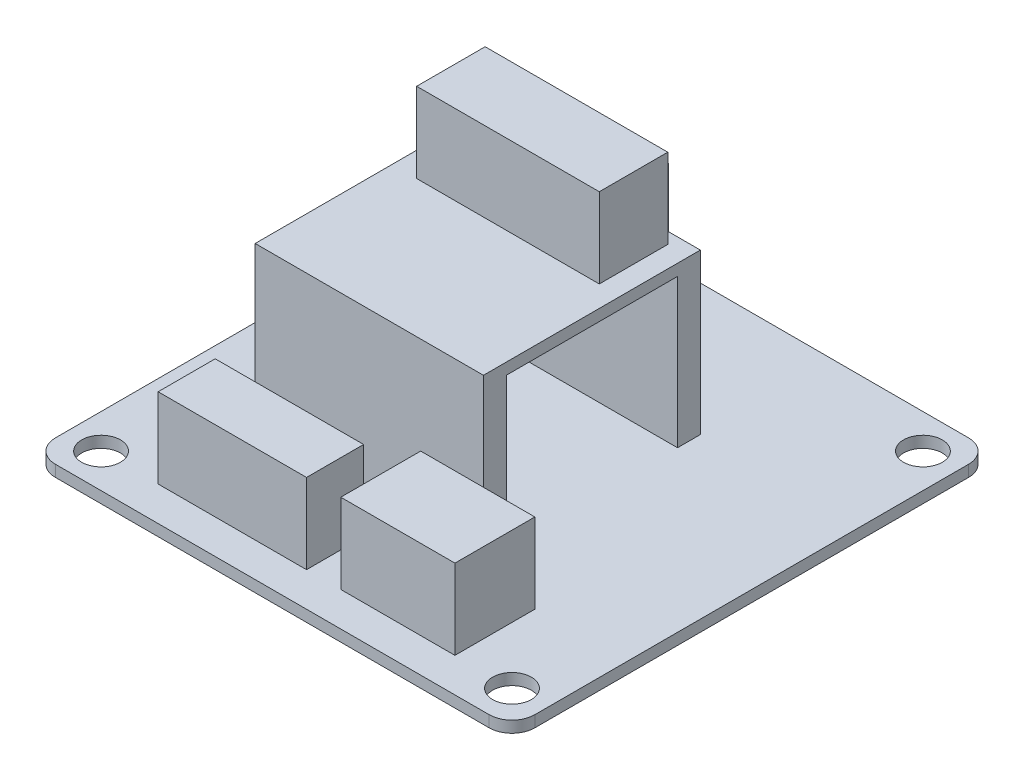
SolidWorks part; units mm, degrees
ref_plane "前视基准面" through (0, 0, 0) normal (0, 0, 1) x (1, 0, 0)
ref_plane "上视基准面" through (0, 0, 0) normal (0, 1, 0) x (1, 0, 0)
ref_plane "右视基准面" through (0, 0, 0) normal (1, 0, 0) x (0, 0, -1)
sketch "草图2" plane through (0, 0, 0) normal (0, 1, 0) x (1, 0, 0)
  line L1 (-21, 21) -> (21, 21)
  line L2 (-21, 21) -> (-21, -21)
  line L3 (-21, -21) -> (21, -21)
  line L4 (21, 21) -> (21, -21)
  line L5 (-21, 21) -> (21, -21) construction
  line L6 (-21, -21) -> (21, 21) construction
  line L7 (-18, 18) -> (18, 18) construction
  line L8 (-18, 18) -> (-18, -18) construction
  line L9 (-18, -18) -> (18, -18) construction
  line L10 (18, 18) -> (18, -18) construction
  line L11 (-18, 18) -> (18, -18) construction
  line L12 (-18, -18) -> (18, 18) construction
  point P0 (0, 0)
  point P6 (0, 0)
  dimension "D1" = 42
  dimension "D2" = 42
  dimension "D3" = 36
  dimension "D4" = 36
extrude "凸台-拉伸1" add sketch "草图2" against normal blind 1
sketch "草图3" plane through (0, 0, 0) normal (0, 1, 0) x (1, 0, 0)
  line L0 (-21, 21) -> (21, -21) construction
  line L1 (21, 21) -> (-21, -21) construction
  line L2 (0, 0) -> (38.6981, 0) construction
  line L3 (-18, 18) -> (18, 18) construction
  line L4 (-18, 18) -> (-18, -18) construction
  line L5 (-18, -18) -> (18, -18) construction
  line L6 (18, 18) -> (18, -18) construction
  line L7 (-18, 18) -> (18, -18) construction
  line L8 (-18, -18) -> (18, 18) construction
  line L9 (0, 0) -> (0, 44.231) construction
  circle A0 centre (-18, 18) radius 1.7
  circle A1 centre (18, 18) radius 1.7
  circle A2 centre (18, -18) radius 1.7
  circle A3 centre (-18, -18) radius 1.7
  point P8 (0, 0)
  dimension "D3" = 3.4
  dimension "D1" = 36
  dimension "D2" = 36
extrude "切除-拉伸1" cut sketch "草图3" against normal through all
sketch "草图4" plane through (0, 0, 0) normal (0, 1, 0) x (1, 0, 0)
  line L0 (-33.7655, 0) -> (28.3389, 0) construction
  line L1 (0, 31.7348) -> (0, -30.5192) construction
  line L3 (-13, 9.5) -> (7, 9.5)
  line L4 (-13, 9.5) -> (-13, 7.5)
  line L5 (-13, 7.5) -> (7, 7.5)
  line L6 (7, 9.5) -> (7, 7.5)
  line L7 (-21, 21) -> (-21, -21) construction
  line L8 (-13, -7.5) -> (7, -7.5)
  line L9 (7, -9.5) -> (7, -7.5)
  line L10 (-13, -9.5) -> (7, -9.5)
  line L11 (-13, -9.5) -> (-13, -7.5)
  dimension "D1" = 20
  dimension "D2" = 2
  dimension "D3" = 7.5
  dimension "D4" = 8
extrude "凸台-拉伸2" add sketch "草图4" along normal blind 13
sketch "草图5" plane through (0, 13, 0) normal (0, 1, 0) x (1, 0, 0)
  line L1 (-13, 9.5) -> (7, 9.5)
  line L2 (-13, 9.5) -> (-13, -9.5)
  line L3 (-13, -9.5) -> (7, -9.5)
  line L4 (7, 9.5) -> (7, -9.5)
extrude "凸台-拉伸3" add sketch "草图5" along normal blind 1
sketch "草图6" plane through (0, 0, 0) normal (0, 1, 0) x (1, 0, 0)
  line L0 (-21, -21) -> (21, -21) construction
  line L1 (-13, -13) -> (0, -13)
  line L2 (-13, -13) -> (-13, -18)
  line L3 (-13, -18) -> (0, -18)
  line L4 (0, -13) -> (0, -18)
  line L5 (-21, 21) -> (-21, -21) construction
  dimension "D1" = 13
  dimension "D2" = 5
  dimension "D3" = 3
  dimension "D4" = 8
extrude "凸台-拉伸4" add sketch "草图6" along normal blind 7
sketch "草图7" plane through (0, 0, 0) normal (0, 1, 0) x (1, 0, 0)
  line L0 (-21, -21) -> (21, -21) construction
  line L1 (3, -11) -> (13, -11)
  line L2 (3, -11) -> (3, -18)
  line L3 (3, -18) -> (13, -18)
  line L4 (13, -11) -> (13, -18)
  line L5 (21, -21) -> (21, 21) construction
  dimension "D1" = 10
  dimension "D2" = 7
  dimension "D3" = 3
  dimension "D4" = 8
extrude "凸台-拉伸5" add sketch "草图7" along normal blind 7
sketch "草图10" plane through (0, 0, 0) normal (0, 1, 0) x (1, 0, 0)
  line L0 (-21, 21) -> (-21, -21) construction
  line L1 (-12, 20) -> (-4, 20)
  line L2 (-12, 20) -> (-12, 12)
  line L3 (-12, 12) -> (-4, 12)
  line L4 (-4, 20) -> (-4, 12)
  line L5 (-12, 20) -> (-4, 12) construction
  line L6 (-12, 12) -> (-4, 20) construction
  line L7 (21, 21) -> (-21, 21) construction
  point P0 (-8, 16)
  dimension "D1" = 8
  dimension "D2" = 9
  dimension "D3" = 1
extrude "凸台-拉伸6" add sketch "草图10" along normal blind 2
sketch "草图11" plane through (0, 2, 0) normal (0, 1, 0) x (1, 0, 0)
  line L0 (-12, 20) -> (-4, 12) construction
  line L1 (-4, 20) -> (-12, 12) construction
  line L2 (-4, 20) -> (-12, 20) construction
  circle A0 centre (-10.4, 18.4) radius 0.35
  circle A1 centre (-7.8, 18.4) radius 0.35
  circle A2 centre (-5.2, 18.4) radius 0.35
  circle A3 centre (-7.8, 15.8) radius 0.35
  circle A4 centre (-5.2, 15.8) radius 0.35
  circle A5 centre (-7.8, 13.2) radius 0.35
  circle A6 centre (-5.2, 13.2) radius 0.35
  circle A7 centre (-10.4, 15.8) radius 0.35
  circle A8 centre (-10.4, 13.2) radius 0.35
  dimension "D2" = 0.7
  dimension "D1" = 1.6
  dimension "D3" = 3
  dimension "D4" = 3
extrude "凸台-拉伸7" add sketch "草图11" along normal blind 8
sketch "草图12" plane through (0, 14, 0) normal (0, 1, 0) x (1, 0, 0)
  line L0 (7, 9.5) -> (-13, 9.5) construction
  line L1 (-10.8532, 8.5) -> (5.1468, 8.5)
  line L2 (-10.8532, 8.5) -> (-10.8532, 2.5)
  line L3 (-10.8532, 2.5) -> (5.1468, 2.5)
  line L4 (5.1468, 8.5) -> (5.1468, 2.5)
  line L5 (-13, 9.5) -> (-13, -9.5) construction
  dimension "D1" = 6
  dimension "D2" = 16
  dimension "D3" = 1
  dimension "D4" = 2.1468
extrude "凸台-拉伸8" add sketch "草图12" along normal blind 7
shell "抽壳1" thickness 1
fillet "圆角1" radius 2 4 edges at (-21, -0.5, -21) (-21, -0.5, 21) (21, -0.5, 21) (21, -0.5, -21)
